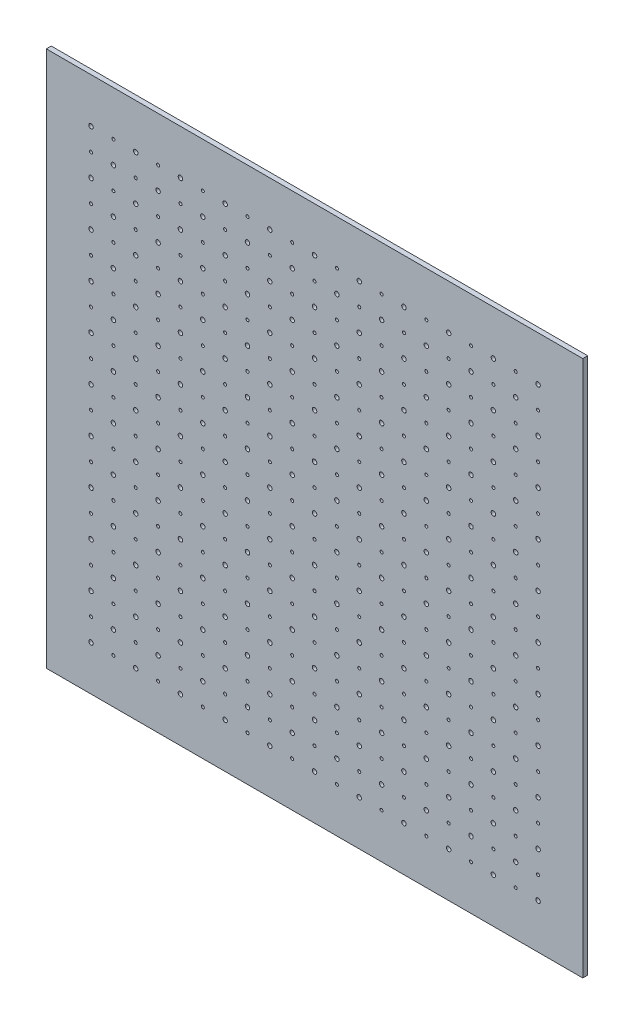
SolidWorks part; units mm, degrees
ref_plane "Front Plane" through (0, 0, 0) normal (0, 0, 1) x (1, 0, 0)
ref_plane "Top Plane" through (0, 0, 0) normal (0, 1, 0) x (1, 0, 0)
ref_plane "Right Plane" through (0, 0, 0) normal (1, 0, 0) x (0, 0, -1)
sketch "Sketch1" plane through (0, 0, 0) normal (0, 0, 1) x (1, 0, 0)
  line L1 (-304.8, -304.8) -> (304.8, -304.8)
  line L2 (-304.8, -304.8) -> (-304.8, 304.8)
  line L3 (-304.8, 304.8) -> (304.8, 304.8)
  line L4 (304.8, -304.8) -> (304.8, 304.8)
  line L5 (-304.8, -304.8) -> (304.8, 304.8) construction
  line L6 (-304.8, 304.8) -> (304.8, -304.8) construction
  point P0 (0, 0)
  dimension "D1" = 609.6
  dimension "D2" = 609.6
extrude "Boss-Extrude1" add sketch "Sketch1" along normal mid plane 5.588
sketch "Sketch2" plane through (0, 0, 0) normal (0, 0, 1) x (1, 0, 0)
  line L0 (304.8, -304.8) -> (304.8, 304.8) construction
  line L1 (-304.8, 304.8) -> (-292.1, 304.8)
  line L2 (-304.8, 304.8) -> (-304.8, 292.1)
  line L3 (-304.8, 292.1) -> (-292.1, 292.1)
  line L4 (-292.1, 304.8) -> (-292.1, 292.1)
  line L5 (304.8, 304.8) -> (292.1, 304.8)
  line L6 (304.8, 304.8) -> (304.8, 292.1)
  line L7 (304.8, 292.1) -> (292.1, 292.1)
  line L8 (292.1, 304.8) -> (292.1, 292.1)
  line L10 (304.8, -304.8) -> (292.1, -304.8)
  line L11 (304.8, -304.8) -> (304.8, -292.1)
  line L12 (304.8, -292.1) -> (292.1, -292.1)
  line L13 (292.1, -304.8) -> (292.1, -292.1)
  line L14 (-304.8, -304.8) -> (-292.1, -304.8)
  line L15 (-304.8, -304.8) -> (-304.8, -292.1)
  line L16 (-304.8, -292.1) -> (-292.1, -292.1)
  line L17 (-292.1, -304.8) -> (-292.1, -292.1)
  dimension "D1" = 12.7
extrude "Cut-Extrude1" [suppressed] cut sketch "Sketch2" against normal through all and the other way through all
hole_wizard "1/4-20 Tapped Hole2" positions "Sketch6" profile "Sketch5" tap size "1/4-20" standard "ANSI Inch"
sketch "Sketch6" plane through (0, 0, 2.794) normal (0, 0, 1) x (1, 0, 0)
  line L0 (-304.8, 304.8) -> (-304.8, -304.8) construction
  line L1 (-304.8, -304.8) -> (304.8, -304.8) construction
  point P0 (-254, -254)
  point P460 (-228.6, -254)
  point P461 (-203.2, -254)
  point P462 (-177.8, -254)
  point P463 (-152.4, -254)
  point P464 (-127, -254)
  point P465 (-101.6, -254)
  point P466 (-76.2, -254)
  point P467 (-50.8, -254)
  point P468 (-25.4, -254)
  point P469 (0, -254)
  point P470 (25.4, -254)
  point P471 (50.8, -254)
  point P472 (76.2, -254)
  point P473 (101.6, -254)
  point P474 (127, -254)
  point P475 (152.4, -254)
  point P476 (177.8, -254)
  point P477 (203.2, -254)
  point P478 (228.6, -254)
  point P479 (254, -254)
  point P480 (-228.6, -228.6)
  point P481 (-203.2, -228.6)
  point P482 (-177.8, -228.6)
  point P483 (-152.4, -228.6)
  point P484 (-127, -228.6)
  point P485 (-101.6, -228.6)
  point P486 (-76.2, -228.6)
  point P487 (-50.8, -228.6)
  point P488 (-25.4, -228.6)
  point P489 (0, -228.6)
  point P490 (25.4, -228.6)
  point P491 (50.8, -228.6)
  point P492 (76.2, -228.6)
  point P493 (101.6, -228.6)
  point P494 (127, -228.6)
  point P495 (152.4, -228.6)
  point P496 (177.8, -228.6)
  point P497 (203.2, -228.6)
  point P498 (228.6, -228.6)
  point P499 (254, -228.6)
  point P500 (-228.6, -203.2)
  point P501 (-203.2, -203.2)
  point P502 (-177.8, -203.2)
  point P503 (-152.4, -203.2)
  point P504 (-127, -203.2)
  point P505 (-101.6, -203.2)
  point P506 (-76.2, -203.2)
  point P507 (-50.8, -203.2)
  point P508 (-25.4, -203.2)
  point P509 (0, -203.2)
  point P510 (25.4, -203.2)
  point P511 (50.8, -203.2)
  point P512 (76.2, -203.2)
  point P513 (101.6, -203.2)
  point P514 (127, -203.2)
  point P515 (152.4, -203.2)
  point P516 (177.8, -203.2)
  point P517 (203.2, -203.2)
  point P518 (228.6, -203.2)
  point P519 (254, -203.2)
  point P520 (-228.6, -177.8)
  point P521 (-203.2, -177.8)
  point P522 (-177.8, -177.8)
  point P523 (-152.4, -177.8)
  point P524 (-127, -177.8)
  point P525 (-101.6, -177.8)
  point P526 (-76.2, -177.8)
  point P527 (-50.8, -177.8)
  point P528 (-25.4, -177.8)
  point P529 (0, -177.8)
  point P530 (25.4, -177.8)
  point P531 (50.8, -177.8)
  point P532 (76.2, -177.8)
  point P533 (101.6, -177.8)
  point P534 (127, -177.8)
  point P535 (152.4, -177.8)
  point P536 (177.8, -177.8)
  point P537 (203.2, -177.8)
  point P538 (228.6, -177.8)
  point P539 (254, -177.8)
  point P540 (-228.6, -152.4)
  point P541 (-203.2, -152.4)
  point P542 (-177.8, -152.4)
  point P543 (-152.4, -152.4)
  point P544 (-127, -152.4)
  point P545 (-101.6, -152.4)
  point P546 (-76.2, -152.4)
  point P547 (-50.8, -152.4)
  point P548 (-25.4, -152.4)
  point P549 (0, -152.4)
  point P550 (25.4, -152.4)
  point P551 (50.8, -152.4)
  point P552 (76.2, -152.4)
  point P553 (101.6, -152.4)
  point P554 (127, -152.4)
  point P555 (152.4, -152.4)
  point P556 (177.8, -152.4)
  point P557 (203.2, -152.4)
  point P558 (228.6, -152.4)
  point P559 (254, -152.4)
  point P560 (-228.6, -127)
  point P561 (-203.2, -127)
  point P562 (-177.8, -127)
  point P563 (-152.4, -127)
  point P564 (-127, -127)
  point P565 (-101.6, -127)
  point P566 (-76.2, -127)
  point P567 (-50.8, -127)
  point P568 (-25.4, -127)
  point P569 (0, -127)
  point P570 (25.4, -127)
  point P571 (50.8, -127)
  point P572 (76.2, -127)
  point P573 (101.6, -127)
  point P574 (127, -127)
  point P575 (152.4, -127)
  point P576 (177.8, -127)
  point P577 (203.2, -127)
  point P578 (228.6, -127)
  point P579 (254, -127)
  point P580 (-228.6, -101.6)
  point P581 (-203.2, -101.6)
  point P582 (-177.8, -101.6)
  point P583 (-152.4, -101.6)
  point P584 (-127, -101.6)
  point P585 (-101.6, -101.6)
  point P586 (-76.2, -101.6)
  point P587 (-50.8, -101.6)
  point P588 (-25.4, -101.6)
  point P589 (0, -101.6)
  point P590 (25.4, -101.6)
  point P591 (50.8, -101.6)
  point P592 (76.2, -101.6)
  point P593 (101.6, -101.6)
  point P594 (127, -101.6)
  point P595 (152.4, -101.6)
  point P596 (177.8, -101.6)
  point P597 (203.2, -101.6)
  point P598 (228.6, -101.6)
  point P599 (254, -101.6)
  point P600 (-228.6, -76.2)
  point P601 (-203.2, -76.2)
  point P602 (-177.8, -76.2)
  point P603 (-152.4, -76.2)
  point P604 (-127, -76.2)
  point P605 (-101.6, -76.2)
  point P606 (-76.2, -76.2)
  point P607 (-50.8, -76.2)
  point P608 (-25.4, -76.2)
  point P609 (0, -76.2)
  point P610 (25.4, -76.2)
  point P611 (50.8, -76.2)
  point P612 (76.2, -76.2)
  point P613 (101.6, -76.2)
  point P614 (127, -76.2)
  point P615 (152.4, -76.2)
  point P616 (177.8, -76.2)
  point P617 (203.2, -76.2)
  point P618 (228.6, -76.2)
  point P619 (254, -76.2)
  point P620 (-228.6, -50.8)
  point P621 (-203.2, -50.8)
  point P622 (-177.8, -50.8)
  point P623 (-152.4, -50.8)
  point P624 (-127, -50.8)
  point P625 (-101.6, -50.8)
  point P626 (-76.2, -50.8)
  point P627 (-50.8, -50.8)
  point P628 (-25.4, -50.8)
  point P629 (0, -50.8)
  point P630 (25.4, -50.8)
  point P631 (50.8, -50.8)
  point P632 (76.2, -50.8)
  point P633 (101.6, -50.8)
  point P634 (127, -50.8)
  point P635 (152.4, -50.8)
  point P636 (177.8, -50.8)
  point P637 (203.2, -50.8)
  point P638 (228.6, -50.8)
  point P639 (254, -50.8)
  point P640 (-228.6, -25.4)
  point P641 (-203.2, -25.4)
  point P642 (-177.8, -25.4)
  point P643 (-152.4, -25.4)
  point P644 (-127, -25.4)
  point P645 (-101.6, -25.4)
  point P646 (-76.2, -25.4)
  point P647 (-50.8, -25.4)
  point P648 (-25.4, -25.4)
  point P649 (0, -25.4)
  point P650 (25.4, -25.4)
  point P651 (50.8, -25.4)
  point P652 (76.2, -25.4)
  point P653 (101.6, -25.4)
  point P654 (127, -25.4)
  point P655 (152.4, -25.4)
  point P656 (177.8, -25.4)
  point P657 (203.2, -25.4)
  point P658 (228.6, -25.4)
  point P659 (254, -25.4)
  point P660 (-228.6, 0)
  point P661 (-203.2, 0)
  point P662 (-177.8, 0)
  point P663 (-152.4, 0)
  point P664 (-127, 0)
  point P665 (-101.6, 0)
  point P666 (-76.2, 0)
  point P667 (-50.8, 0)
  point P668 (-25.4, 0)
  point P669 (0, 0)
  point P670 (25.4, 0)
  point P671 (50.8, 0)
  point P672 (76.2, 0)
  point P673 (101.6, 0)
  point P674 (127, 0)
  point P675 (152.4, 0)
  point P676 (177.8, 0)
  point P677 (203.2, 0)
  point P678 (228.6, 0)
  point P679 (254, 0)
  point P680 (-228.6, 25.4)
  point P681 (-203.2, 25.4)
  point P682 (-177.8, 25.4)
  point P683 (-152.4, 25.4)
  point P684 (-127, 25.4)
  point P685 (-101.6, 25.4)
  point P686 (-76.2, 25.4)
  point P687 (-50.8, 25.4)
  point P688 (-25.4, 25.4)
  point P689 (0, 25.4)
  point P690 (25.4, 25.4)
  point P691 (50.8, 25.4)
  point P692 (76.2, 25.4)
  point P693 (101.6, 25.4)
  point P694 (127, 25.4)
  point P695 (152.4, 25.4)
  point P696 (177.8, 25.4)
  point P697 (203.2, 25.4)
  point P698 (228.6, 25.4)
  point P699 (254, 25.4)
  point P700 (-228.6, 50.8)
  point P701 (-203.2, 50.8)
  point P702 (-177.8, 50.8)
  point P703 (-152.4, 50.8)
  point P704 (-127, 50.8)
  point P705 (-101.6, 50.8)
  point P706 (-76.2, 50.8)
  point P707 (-50.8, 50.8)
  point P708 (-25.4, 50.8)
  point P709 (0, 50.8)
  point P710 (25.4, 50.8)
  point P711 (50.8, 50.8)
  point P712 (76.2, 50.8)
  point P713 (101.6, 50.8)
  point P714 (127, 50.8)
  point P715 (152.4, 50.8)
  point P716 (177.8, 50.8)
  point P717 (203.2, 50.8)
  point P718 (228.6, 50.8)
  point P719 (254, 50.8)
  point P720 (-228.6, 76.2)
  point P721 (-203.2, 76.2)
  point P722 (-177.8, 76.2)
  point P723 (-152.4, 76.2)
  point P724 (-127, 76.2)
  point P725 (-101.6, 76.2)
  point P726 (-76.2, 76.2)
  point P727 (-50.8, 76.2)
  point P728 (-25.4, 76.2)
  point P729 (0, 76.2)
  point P730 (25.4, 76.2)
  point P731 (50.8, 76.2)
  point P732 (76.2, 76.2)
  point P733 (101.6, 76.2)
  point P734 (127, 76.2)
  point P735 (152.4, 76.2)
  point P736 (177.8, 76.2)
  point P737 (203.2, 76.2)
  point P738 (228.6, 76.2)
  point P739 (254, 76.2)
  point P740 (-228.6, 101.6)
  point P741 (-203.2, 101.6)
  point P742 (-177.8, 101.6)
  point P743 (-152.4, 101.6)
  point P744 (-127, 101.6)
  point P745 (-101.6, 101.6)
  point P746 (-76.2, 101.6)
  point P747 (-50.8, 101.6)
  point P748 (-25.4, 101.6)
  point P749 (0, 101.6)
  point P750 (25.4, 101.6)
  point P751 (50.8, 101.6)
  point P752 (76.2, 101.6)
  point P753 (101.6, 101.6)
  point P754 (127, 101.6)
  point P755 (152.4, 101.6)
  point P756 (177.8, 101.6)
  point P757 (203.2, 101.6)
  point P758 (228.6, 101.6)
  point P759 (254, 101.6)
  point P760 (-228.6, 127)
  point P761 (-203.2, 127)
  point P762 (-177.8, 127)
  point P763 (-152.4, 127)
  point P764 (-127, 127)
  point P765 (-101.6, 127)
  point P766 (-76.2, 127)
  point P767 (-50.8, 127)
  point P768 (-25.4, 127)
  point P769 (0, 127)
  point P770 (25.4, 127)
  point P771 (50.8, 127)
  point P772 (76.2, 127)
  point P773 (101.6, 127)
  point P774 (127, 127)
  point P775 (152.4, 127)
  point P776 (177.8, 127)
  point P777 (203.2, 127)
  point P778 (228.6, 127)
  point P779 (254, 127)
  point P780 (-228.6, 152.4)
  point P781 (-203.2, 152.4)
  point P782 (-177.8, 152.4)
  point P783 (-152.4, 152.4)
  point P784 (-127, 152.4)
  point P785 (-101.6, 152.4)
  point P786 (-76.2, 152.4)
  point P787 (-50.8, 152.4)
  point P788 (-25.4, 152.4)
  point P789 (0, 152.4)
  point P790 (25.4, 152.4)
  point P791 (50.8, 152.4)
  point P792 (76.2, 152.4)
  point P793 (101.6, 152.4)
  point P794 (127, 152.4)
  point P795 (152.4, 152.4)
  point P796 (177.8, 152.4)
  point P797 (203.2, 152.4)
  point P798 (228.6, 152.4)
  point P799 (254, 152.4)
  point P800 (-228.6, 177.8)
  point P801 (-203.2, 177.8)
  point P802 (-177.8, 177.8)
  point P803 (-152.4, 177.8)
  point P804 (-127, 177.8)
  point P805 (-101.6, 177.8)
  point P806 (-76.2, 177.8)
  point P807 (-50.8, 177.8)
  point P808 (-25.4, 177.8)
  point P809 (0, 177.8)
  point P810 (25.4, 177.8)
  point P811 (50.8, 177.8)
  point P812 (76.2, 177.8)
  point P813 (101.6, 177.8)
  point P814 (127, 177.8)
  point P815 (152.4, 177.8)
  point P816 (177.8, 177.8)
  point P817 (203.2, 177.8)
  point P818 (228.6, 177.8)
  point P819 (254, 177.8)
  point P820 (-228.6, 203.2)
  point P821 (-203.2, 203.2)
  point P822 (-177.8, 203.2)
  point P823 (-152.4, 203.2)
  point P824 (-127, 203.2)
  point P825 (-101.6, 203.2)
  point P826 (-76.2, 203.2)
  point P827 (-50.8, 203.2)
  point P828 (-25.4, 203.2)
  point P829 (0, 203.2)
  point P830 (25.4, 203.2)
  point P831 (50.8, 203.2)
  point P832 (76.2, 203.2)
  point P833 (101.6, 203.2)
  point P834 (127, 203.2)
  point P835 (152.4, 203.2)
  point P836 (177.8, 203.2)
  point P837 (203.2, 203.2)
  point P838 (228.6, 203.2)
  point P839 (254, 203.2)
  point P840 (-228.6, 228.6)
  point P841 (-203.2, 228.6)
  point P842 (-177.8, 228.6)
  point P843 (-152.4, 228.6)
  point P844 (-127, 228.6)
  point P845 (-101.6, 228.6)
  point P846 (-76.2, 228.6)
  point P847 (-50.8, 228.6)
  point P848 (-25.4, 228.6)
  point P849 (0, 228.6)
  point P850 (25.4, 228.6)
  point P851 (50.8, 228.6)
  point P852 (76.2, 228.6)
  point P853 (101.6, 228.6)
  point P854 (127, 228.6)
  point P855 (152.4, 228.6)
  point P856 (177.8, 228.6)
  point P857 (203.2, 228.6)
  point P858 (228.6, 228.6)
  point P859 (254, 228.6)
  point P860 (-228.6, 254)
  point P861 (-203.2, 254)
  point P862 (-177.8, 254)
  point P863 (-152.4, 254)
  point P864 (-127, 254)
  point P865 (-101.6, 254)
  point P866 (-76.2, 254)
  point P867 (-50.8, 254)
  point P868 (-25.4, 254)
  point P869 (0, 254)
  point P870 (25.4, 254)
  point P871 (50.8, 254)
  point P872 (76.2, 254)
  point P873 (101.6, 254)
  point P874 (127, 254)
  point P875 (152.4, 254)
  point P876 (177.8, 254)
  point P877 (203.2, 254)
  point P878 (228.6, 254)
  point P879 (254, 254)
  point P880 (-254, -228.6)
  point P881 (-254, -203.2)
  point P882 (-254, -177.8)
  point P883 (-254, -152.4)
  point P884 (-254, -127)
  point P885 (-254, -101.6)
  point P886 (-254, -76.2)
  point P887 (-254, -50.8)
  point P888 (-254, -25.4)
  point P889 (-254, 0)
  point P890 (-254, 25.4)
  point P891 (-254, 50.8)
  point P892 (-254, 76.2)
  point P893 (-254, 101.6)
  point P894 (-254, 127)
  point P895 (-254, 152.4)
  point P896 (-254, 177.8)
  point P897 (-254, 203.2)
  point P898 (-254, 228.6)
  point P899 (-254, 254)
  dimension "D1" = 50.8
  dimension "D2" = 50.8
  dimension "D3" = 21
  dimension "D4" = 21
sketch "Sketch5" plane through (-254, -254, 2.794) normal (1, 0, 0) x (0, -1, 0)
  line L0 (0, 0) -> (0, 5.588)
  line L1 (0, 5.588) -> (2.5527, 5.588)
  line L2 (2.5527, 5.588) -> (2.5527, 0)
  line L5 (2.5527, 0) -> (0, 0)
  line L11 (0, -6.35) -> (0, 107.95) construction
  dimension "Thread Major Dia." = 5.1054
  dimension "Thru Tap Drill Depth" = 5.588
hole_wizard "#8-32 Tapped Hole1" positions "Sketch8" profile "Sketch7" tap size "#8-32" standard "ANSI Inch"
sketch "Sketch8" plane through (0, 0, 2.794) normal (0, 0, 1) x (1, 0, 0)
  line L0 (-304.8, -304.8) -> (304.8, -304.8) construction
  line L1 (-304.8, 304.8) -> (-304.8, -304.8) construction
  point P0 (-254, -254)
  point P244 (-228.6, -254)
  point P245 (-203.2, -254)
  point P246 (-177.8, -254)
  point P247 (-152.4, -254)
  point P248 (-127, -254)
  point P249 (-101.6, -254)
  point P250 (-76.2, -254)
  point P251 (-50.8, -254)
  point P252 (-25.4, -254)
  point P253 (0, -254)
  point P254 (25.4, -254)
  point P255 (50.8, -254)
  point P256 (76.2, -254)
  point P257 (101.6, -254)
  point P258 (127, -254)
  point P259 (152.4, -254)
  point P260 (177.8, -254)
  point P261 (203.2, -254)
  point P262 (228.6, -254)
  point P263 (254, -254)
  point P264 (-228.6, -228.6)
  point P265 (-203.2, -228.6)
  point P266 (-177.8, -228.6)
  point P267 (-152.4, -228.6)
  point P268 (-127, -228.6)
  point P269 (-101.6, -228.6)
  point P270 (-76.2, -228.6)
  point P271 (-50.8, -228.6)
  point P272 (-25.4, -228.6)
  point P273 (0, -228.6)
  point P274 (25.4, -228.6)
  point P275 (50.8, -228.6)
  point P276 (76.2, -228.6)
  point P277 (101.6, -228.6)
  point P278 (127, -228.6)
  point P279 (152.4, -228.6)
  point P280 (177.8, -228.6)
  point P281 (203.2, -228.6)
  point P282 (228.6, -228.6)
  point P283 (254, -228.6)
  point P284 (-228.6, -203.2)
  point P285 (-203.2, -203.2)
  point P286 (-177.8, -203.2)
  point P287 (-152.4, -203.2)
  point P288 (-127, -203.2)
  point P289 (-101.6, -203.2)
  point P290 (-76.2, -203.2)
  point P291 (-50.8, -203.2)
  point P292 (-25.4, -203.2)
  point P293 (0, -203.2)
  point P294 (25.4, -203.2)
  point P295 (50.8, -203.2)
  point P296 (76.2, -203.2)
  point P297 (101.6, -203.2)
  point P298 (127, -203.2)
  point P299 (152.4, -203.2)
  point P300 (177.8, -203.2)
  point P301 (203.2, -203.2)
  point P302 (228.6, -203.2)
  point P303 (254, -203.2)
  point P304 (-228.6, -177.8)
  point P305 (-203.2, -177.8)
  point P306 (-177.8, -177.8)
  point P307 (-152.4, -177.8)
  point P308 (-127, -177.8)
  point P309 (-101.6, -177.8)
  point P310 (-76.2, -177.8)
  point P311 (-50.8, -177.8)
  point P312 (-25.4, -177.8)
  point P313 (0, -177.8)
  point P314 (25.4, -177.8)
  point P315 (50.8, -177.8)
  point P316 (76.2, -177.8)
  point P317 (101.6, -177.8)
  point P318 (127, -177.8)
  point P319 (152.4, -177.8)
  point P320 (177.8, -177.8)
  point P321 (203.2, -177.8)
  point P322 (228.6, -177.8)
  point P323 (254, -177.8)
  point P324 (-228.6, -152.4)
  point P325 (-203.2, -152.4)
  point P326 (-177.8, -152.4)
  point P327 (-152.4, -152.4)
  point P328 (-127, -152.4)
  point P329 (-101.6, -152.4)
  point P330 (-76.2, -152.4)
  point P331 (-50.8, -152.4)
  point P332 (-25.4, -152.4)
  point P333 (0, -152.4)
  point P334 (25.4, -152.4)
  point P335 (50.8, -152.4)
  point P336 (76.2, -152.4)
  point P337 (101.6, -152.4)
  point P338 (127, -152.4)
  point P339 (152.4, -152.4)
  point P340 (177.8, -152.4)
  point P341 (203.2, -152.4)
  point P342 (228.6, -152.4)
  point P343 (254, -152.4)
  point P344 (-228.6, -127)
  point P345 (-203.2, -127)
  point P346 (-177.8, -127)
  point P347 (-152.4, -127)
  point P348 (-127, -127)
  point P349 (-101.6, -127)
  point P350 (-76.2, -127)
  point P351 (-50.8, -127)
  point P352 (-25.4, -127)
  point P353 (0, -127)
  point P354 (25.4, -127)
  point P355 (50.8, -127)
  point P356 (76.2, -127)
  point P357 (101.6, -127)
  point P358 (127, -127)
  point P359 (152.4, -127)
  point P360 (177.8, -127)
  point P361 (203.2, -127)
  point P362 (228.6, -127)
  point P363 (254, -127)
  point P364 (-228.6, -101.6)
  point P365 (-203.2, -101.6)
  point P366 (-177.8, -101.6)
  point P367 (-152.4, -101.6)
  point P368 (-127, -101.6)
  point P369 (-101.6, -101.6)
  point P370 (-76.2, -101.6)
  point P371 (-50.8, -101.6)
  point P372 (-25.4, -101.6)
  point P373 (0, -101.6)
  point P374 (25.4, -101.6)
  point P375 (50.8, -101.6)
  point P376 (76.2, -101.6)
  point P377 (101.6, -101.6)
  point P378 (127, -101.6)
  point P379 (152.4, -101.6)
  point P380 (177.8, -101.6)
  point P381 (203.2, -101.6)
  point P382 (228.6, -101.6)
  point P383 (254, -101.6)
  point P384 (-228.6, -76.2)
  point P385 (-203.2, -76.2)
  point P386 (-177.8, -76.2)
  point P387 (-152.4, -76.2)
  point P388 (-127, -76.2)
  point P389 (-101.6, -76.2)
  point P390 (-76.2, -76.2)
  point P391 (-50.8, -76.2)
  point P392 (-25.4, -76.2)
  point P393 (0, -76.2)
  point P394 (25.4, -76.2)
  point P395 (50.8, -76.2)
  point P396 (76.2, -76.2)
  point P397 (101.6, -76.2)
  point P398 (127, -76.2)
  point P399 (152.4, -76.2)
  point P400 (177.8, -76.2)
  point P401 (203.2, -76.2)
  point P402 (228.6, -76.2)
  point P403 (254, -76.2)
  point P404 (-228.6, -50.8)
  point P405 (-203.2, -50.8)
  point P406 (-177.8, -50.8)
  point P407 (-152.4, -50.8)
  point P408 (-127, -50.8)
  point P409 (-101.6, -50.8)
  point P410 (-76.2, -50.8)
  point P411 (-50.8, -50.8)
  point P412 (-25.4, -50.8)
  point P413 (0, -50.8)
  point P414 (25.4, -50.8)
  point P415 (50.8, -50.8)
  point P416 (76.2, -50.8)
  point P417 (101.6, -50.8)
  point P418 (127, -50.8)
  point P419 (152.4, -50.8)
  point P420 (177.8, -50.8)
  point P421 (203.2, -50.8)
  point P422 (228.6, -50.8)
  point P423 (254, -50.8)
  point P424 (-228.6, -25.4)
  point P425 (-203.2, -25.4)
  point P426 (-177.8, -25.4)
  point P427 (-152.4, -25.4)
  point P428 (-127, -25.4)
  point P429 (-101.6, -25.4)
  point P430 (-76.2, -25.4)
  point P431 (-50.8, -25.4)
  point P432 (-25.4, -25.4)
  point P433 (0, -25.4)
  point P434 (25.4, -25.4)
  point P435 (50.8, -25.4)
  point P436 (76.2, -25.4)
  point P437 (101.6, -25.4)
  point P438 (127, -25.4)
  point P439 (152.4, -25.4)
  point P440 (177.8, -25.4)
  point P441 (203.2, -25.4)
  point P442 (228.6, -25.4)
  point P443 (254, -25.4)
  point P444 (-228.6, 0)
  point P445 (-203.2, 0)
  point P446 (-177.8, 0)
  point P447 (-152.4, 0)
  point P448 (-127, 0)
  point P449 (-101.6, 0)
  point P450 (-76.2, 0)
  point P451 (-50.8, 0)
  point P452 (-25.4, 0)
  point P453 (0, 0)
  point P454 (25.4, 0)
  point P455 (50.8, 0)
  point P456 (76.2, 0)
  point P457 (101.6, 0)
  point P458 (127, 0)
  point P459 (152.4, 0)
  point P460 (177.8, 0)
  point P461 (203.2, 0)
  point P462 (228.6, 0)
  point P463 (254, 0)
  point P464 (-228.6, 25.4)
  point P465 (-203.2, 25.4)
  point P466 (-177.8, 25.4)
  point P467 (-152.4, 25.4)
  point P468 (-127, 25.4)
  point P469 (-101.6, 25.4)
  point P470 (-76.2, 25.4)
  point P471 (-50.8, 25.4)
  point P472 (-25.4, 25.4)
  point P473 (0, 25.4)
  point P474 (25.4, 25.4)
  point P475 (50.8, 25.4)
  point P476 (76.2, 25.4)
  point P477 (101.6, 25.4)
  point P478 (127, 25.4)
  point P479 (152.4, 25.4)
  point P480 (177.8, 25.4)
  point P481 (203.2, 25.4)
  point P482 (228.6, 25.4)
  point P483 (254, 25.4)
  point P484 (-228.6, 50.8)
  point P485 (-203.2, 50.8)
  point P486 (-177.8, 50.8)
  point P487 (-152.4, 50.8)
  point P488 (-127, 50.8)
  point P489 (-101.6, 50.8)
  point P490 (-76.2, 50.8)
  point P491 (-50.8, 50.8)
  point P492 (-25.4, 50.8)
  point P493 (0, 50.8)
  point P494 (25.4, 50.8)
  point P495 (50.8, 50.8)
  point P496 (76.2, 50.8)
  point P497 (101.6, 50.8)
  point P498 (127, 50.8)
  point P499 (152.4, 50.8)
  point P500 (177.8, 50.8)
  point P501 (203.2, 50.8)
  point P502 (228.6, 50.8)
  point P503 (254, 50.8)
  point P504 (-228.6, 76.2)
  point P505 (-203.2, 76.2)
  point P506 (-177.8, 76.2)
  point P507 (-152.4, 76.2)
  point P508 (-127, 76.2)
  point P509 (-101.6, 76.2)
  point P510 (-76.2, 76.2)
  point P511 (-50.8, 76.2)
  point P512 (-25.4, 76.2)
  point P513 (0, 76.2)
  point P514 (25.4, 76.2)
  point P515 (50.8, 76.2)
  point P516 (76.2, 76.2)
  point P517 (101.6, 76.2)
  point P518 (127, 76.2)
  point P519 (152.4, 76.2)
  point P520 (177.8, 76.2)
  point P521 (203.2, 76.2)
  point P522 (228.6, 76.2)
  point P523 (254, 76.2)
  point P524 (-228.6, 101.6)
  point P525 (-203.2, 101.6)
  point P526 (-177.8, 101.6)
  point P527 (-152.4, 101.6)
  point P528 (-127, 101.6)
  point P529 (-101.6, 101.6)
  point P530 (-76.2, 101.6)
  point P531 (-50.8, 101.6)
  point P532 (-25.4, 101.6)
  point P533 (0, 101.6)
  point P534 (25.4, 101.6)
  point P535 (50.8, 101.6)
  point P536 (76.2, 101.6)
  point P537 (101.6, 101.6)
  point P538 (127, 101.6)
  point P539 (152.4, 101.6)
  point P540 (177.8, 101.6)
  point P541 (203.2, 101.6)
  point P542 (228.6, 101.6)
  point P543 (254, 101.6)
  point P544 (-228.6, 127)
  point P545 (-203.2, 127)
  point P546 (-177.8, 127)
  point P547 (-152.4, 127)
  point P548 (-127, 127)
  point P549 (-101.6, 127)
  point P550 (-76.2, 127)
  point P551 (-50.8, 127)
  point P552 (-25.4, 127)
  point P553 (0, 127)
  point P554 (25.4, 127)
  point P555 (50.8, 127)
  point P556 (76.2, 127)
  point P557 (101.6, 127)
  point P558 (127, 127)
  point P559 (152.4, 127)
  point P560 (177.8, 127)
  point P561 (203.2, 127)
  point P562 (228.6, 127)
  point P563 (254, 127)
  point P564 (-228.6, 152.4)
  point P565 (-203.2, 152.4)
  point P566 (-177.8, 152.4)
  point P567 (-152.4, 152.4)
  point P568 (-127, 152.4)
  point P569 (-101.6, 152.4)
  point P570 (-76.2, 152.4)
  point P571 (-50.8, 152.4)
  point P572 (-25.4, 152.4)
  point P573 (0, 152.4)
  point P574 (25.4, 152.4)
  point P575 (50.8, 152.4)
  point P576 (76.2, 152.4)
  point P577 (101.6, 152.4)
  point P578 (127, 152.4)
  point P579 (152.4, 152.4)
  point P580 (177.8, 152.4)
  point P581 (203.2, 152.4)
  point P582 (228.6, 152.4)
  point P583 (254, 152.4)
  point P584 (-228.6, 177.8)
  point P585 (-203.2, 177.8)
  point P586 (-177.8, 177.8)
  point P587 (-152.4, 177.8)
  point P588 (-127, 177.8)
  point P589 (-101.6, 177.8)
  point P590 (-76.2, 177.8)
  point P591 (-50.8, 177.8)
  point P592 (-25.4, 177.8)
  point P593 (0, 177.8)
  point P594 (25.4, 177.8)
  point P595 (50.8, 177.8)
  point P596 (76.2, 177.8)
  point P597 (101.6, 177.8)
  point P598 (127, 177.8)
  point P599 (152.4, 177.8)
  point P600 (177.8, 177.8)
  point P601 (203.2, 177.8)
  point P602 (228.6, 177.8)
  point P603 (254, 177.8)
  point P604 (-228.6, 203.2)
  point P605 (-203.2, 203.2)
  point P606 (-177.8, 203.2)
  point P607 (-152.4, 203.2)
  point P608 (-127, 203.2)
  point P609 (-101.6, 203.2)
  point P610 (-76.2, 203.2)
  point P611 (-50.8, 203.2)
  point P612 (-25.4, 203.2)
  point P613 (0, 203.2)
  point P614 (25.4, 203.2)
  point P615 (50.8, 203.2)
  point P616 (76.2, 203.2)
  point P617 (101.6, 203.2)
  point P618 (127, 203.2)
  point P619 (152.4, 203.2)
  point P620 (177.8, 203.2)
  point P621 (203.2, 203.2)
  point P622 (228.6, 203.2)
  point P623 (254, 203.2)
  point P624 (-228.6, 228.6)
  point P625 (-203.2, 228.6)
  point P626 (-177.8, 228.6)
  point P627 (-152.4, 228.6)
  point P628 (-127, 228.6)
  point P629 (-101.6, 228.6)
  point P630 (-76.2, 228.6)
  point P631 (-50.8, 228.6)
  point P632 (-25.4, 228.6)
  point P633 (0, 228.6)
  point P634 (25.4, 228.6)
  point P635 (50.8, 228.6)
  point P636 (76.2, 228.6)
  point P637 (101.6, 228.6)
  point P638 (127, 228.6)
  point P639 (152.4, 228.6)
  point P640 (177.8, 228.6)
  point P641 (203.2, 228.6)
  point P642 (228.6, 228.6)
  point P643 (254, 228.6)
  point P644 (-228.6, 254)
  point P645 (-203.2, 254)
  point P646 (-177.8, 254)
  point P647 (-152.4, 254)
  point P648 (-127, 254)
  point P649 (-101.6, 254)
  point P650 (-76.2, 254)
  point P651 (-50.8, 254)
  point P652 (-25.4, 254)
  point P653 (0, 254)
  point P654 (25.4, 254)
  point P655 (50.8, 254)
  point P656 (76.2, 254)
  point P657 (101.6, 254)
  point P658 (127, 254)
  point P659 (152.4, 254)
  point P660 (177.8, 254)
  point P661 (203.2, 254)
  point P662 (228.6, 254)
  point P663 (254, 254)
  point P664 (-254, -228.6)
  point P665 (-254, -203.2)
  point P666 (-254, -177.8)
  point P667 (-254, -152.4)
  point P668 (-254, -127)
  point P669 (-254, -101.6)
  point P670 (-254, -76.2)
  point P671 (-254, -50.8)
  point P672 (-254, -25.4)
  point P673 (-254, 0)
  point P674 (-254, 25.4)
  point P675 (-254, 50.8)
  point P676 (-254, 76.2)
  point P677 (-254, 101.6)
  point P678 (-254, 127)
  point P679 (-254, 152.4)
  point P680 (-254, 177.8)
  point P681 (-254, 203.2)
  point P682 (-254, 228.6)
  point P683 (-254, 254)
  dimension "D1" = 50.8
  dimension "D2" = 50.8
  dimension "D3" = 21
  dimension "D4" = 21
sketch "Sketch7" plane through (-254, -254, 2.794) normal (1, 0, 0) x (0, -1, 0)
  line L0 (0, 0) -> (0, 5.588)
  line L1 (0, 5.588) -> (1.7272, 5.588)
  line L2 (1.7272, 5.588) -> (1.7272, 0)
  line L5 (1.7272, 0) -> (0, 0)
  line L11 (0, -6.35) -> (0, 107.95) construction
  dimension "Thread Major Dia." = 3.4544
  dimension "Thru Tap Drill Depth" = 5.588
